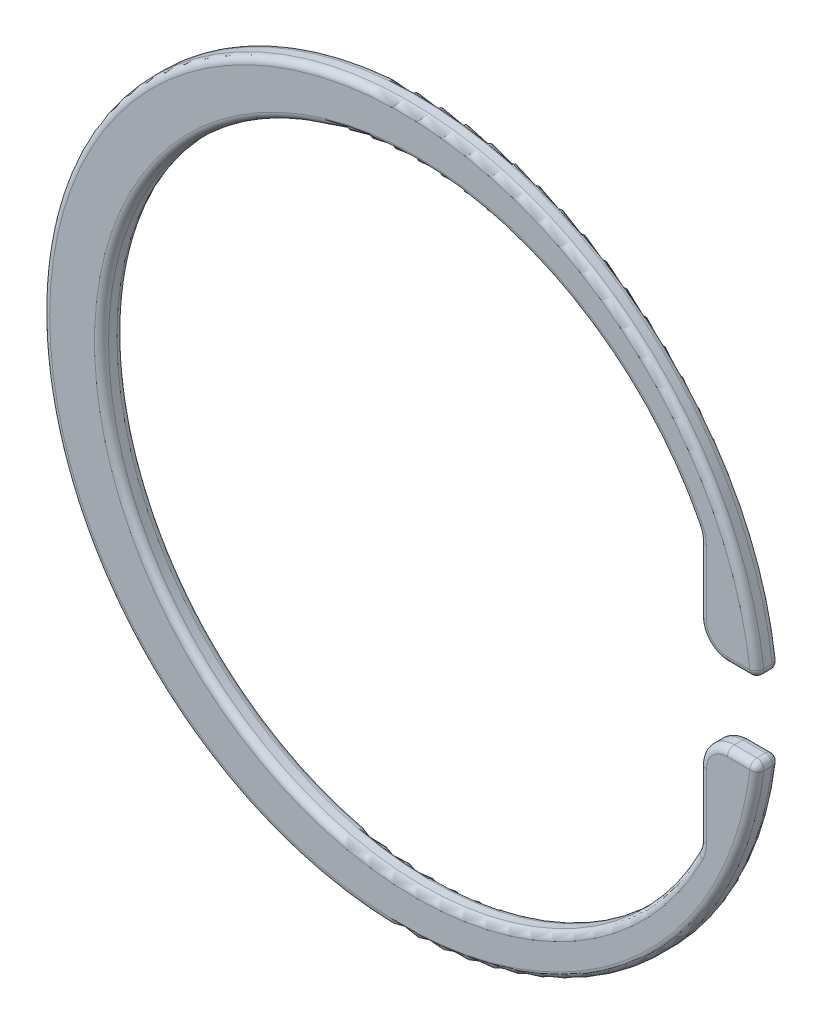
SolidWorks part; units mm, degrees
ref_plane "Front Plane" through (0, 0, 0) normal (0, 0, 1) x (1, 0, 0)
ref_plane "Top Plane" through (0, 0, 0) normal (0, 1, 0) x (1, 0, 0)
ref_plane "Right Plane" through (0, 0, 0) normal (1, 0, 0) x (0, 0, -1)
ref_plane "Plane1" through (0, 0, 0) normal (0, 0, -1) x (-1, 0, 0)
sketch "Sketch1" plane through (0, 0, 0) normal (0, 0, -1) x (-1, 0, 0)
  line L0 (-5.4102, -2.3437) -> (-5.4102, -0.6604)
  line L1 (-5.4102, -0.6604) -> (-6.4688, -0.6604)
  line L2 (-6.4688, 0.6604) -> (-5.4102, 0.6604)
  line L3 (-5.4102, 0.6604) -> (-5.4102, 2.3437)
  arc A0 (-6.4688, -0.6604) -> (-6.4688, 0.6604) centre (0, 0) ccw
  arc A1 (-5.4102, 2.3437) -> (-5.3555, 2.5729) centre (-4.9022, 2.3437) cw
  arc A2 (-5.3555, 2.5729) -> (-5.3555, -2.5729) centre (-0.2667, 0) cw
  arc A3 (-5.3555, -2.5729) -> (-5.4102, -2.3437) centre (-4.9022, -2.3437) cw
extrude "Boss-Extrude1" add sketch "Sketch1" against normal blind 0.4064
fillet "Fillet1" radius 0.508 1 edges at (5.4102, 0.6604, 0.2032)
fillet "Fillet2" radius 0.508 1 edges at (5.4102, -0.6604, 0.2032)
fillet "Fillet3" radius 0.127 22 edges at (6.1935, 0.6604, 0) (5.559, 0.8092, 0) (5.4102, 1.756, 0) (5.3963, 2.4615, 0) (-5.4356, 0, 0) (5.3963, -2.4615, 0) (6.1935, -0.6604, 0) (5.4102, -1.756, 0) (5.559, -0.8092, 0) (-6.5024, 0, 0) (6.4688, -0.6604, 0.2032) (6.4688, 0.6604, 0.2032) (-6.5024, 0, 0.4064) (6.1935, -0.6604, 0.4064) (5.559, -0.8092, 0.4064) (5.4102, -1.756, 0.4064) (5.3963, -2.4615, 0.4064) (-5.4356, 0, 0.4064) (6.1935, 0.6604, 0.4064) (5.3963, 2.4615, 0.4064) (5.559, 0.8092, 0.4064) (5.4102, 1.756, 0.4064)
